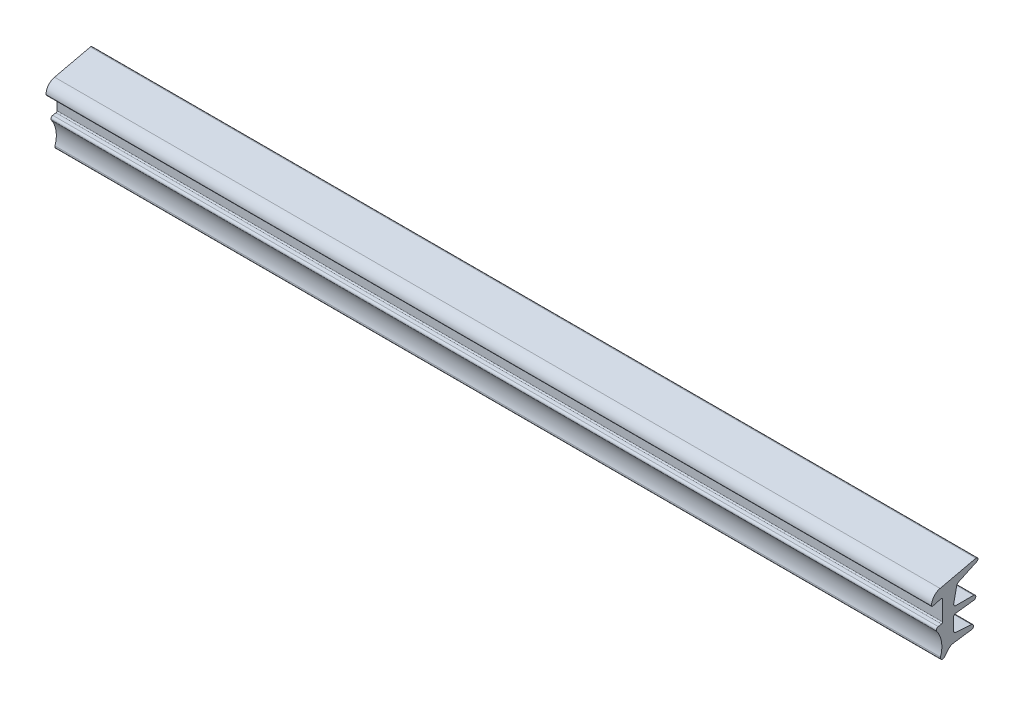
SolidWorks part; units mm, degrees
ref_plane "Front Plane" through (0, 0, 0) normal (0, 0, 1) x (1, 0, 0)
ref_plane "Top Plane" through (0, 0, 0) normal (0, 1, 0) x (1, 0, 0)
ref_plane "Right Plane" through (0, 0, 0) normal (1, 0, 0) x (0, 0, -1)
sketch3d "3DSketch1"
  line L0 (0, 0, 0) -> (200, 0, 0)
  dimension "D1" = 200
other "Paneelitiivisteet 1.6019 PANEELITIIVISTE 2(1)"
ref_plane "Plane1" through (0, 0, 0) normal (1, 0, 0) x (0, 0, -1)
sketch "Sketch1" plane through (0, 0, 0) normal (1, 0, 0) x (0, 0, -1)
  line L0 (2.3793, 4.7591) -> (6.4349, 6.6502)
  line L1 (6.1758, 7.4025) -> (-1.8966, 5.5389)
  line L2 (-3.8342, 3.1029) -> (-3.8342, 3.0945)
  line L3 (-3.5824, 2.9013) -> (-1.7118, 3.4025)
  line L4 (-1.3342, 3.1128) -> (-1.3342, -1.2872)
  line L5 (-1.5821, -1.5827) -> (-2.321, -1.713)
  line L6 (-2.6437, -2.4922) -> (-2.5838, -2.5778)
  line L7 (-0.9534, -8.4086) -> (-0.0613, -7.3455)
  line L8 (1.1924, -6.6506) -> (5.2354, -6.0824)
  line L9 (5.2007, -5.0884) -> (1.6309, -4.8388)
  line L10 (1.1658, -4.34) -> (1.1658, -1.5859)
  line L11 (1.6049, -1.0896) -> (5.7268, -0.5835)
  line L12 (5.6658, 0.4128) -> (1.6658, 0.4128)
  line L13 (1.1768, 1.0167) -> (1.8238, 4.0607)
  arc A0 (6.4349, 6.6502) -> (6.1758, 7.4025) centre (6.2658, 7.0128) ccw
  arc A1 (-1.8966, 5.5389) -> (-3.8342, 3.1029) centre (-1.3342, 3.1029) ccw
  arc A2 (-3.8342, 3.0945) -> (-3.5824, 2.9013) centre (-3.6342, 3.0945) ccw
  arc A3 (-1.3342, 3.1128) -> (-1.7118, 3.4025) centre (-1.6342, 3.1128) ccw
  arc A4 (-1.5821, -1.5827) -> (-1.3342, -1.2872) centre (-1.6342, -1.2872) ccw
  arc A5 (-2.321, -1.713) -> (-2.6437, -2.4922) centre (-2.2342, -2.2054) ccw
  arc A6 (-1.8104, -7.9281) -> (-2.5838, -2.5778) centre (-7.4987, -6.0193) ccw
  arc A7 (-1.8104, -7.9281) -> (-0.9534, -8.4086) centre (-1.3364, -8.0872) ccw
  arc A8 (1.1924, -6.6506) -> (-0.0613, -7.3455) centre (1.4708, -8.6311) ccw
  arc A9 (5.2354, -6.0824) -> (5.2007, -5.0884) centre (5.1658, -5.5872) ccw
  arc A10 (1.1658, -4.34) -> (1.6309, -4.8388) centre (1.6658, -4.34) ccw
  arc A11 (1.6049, -1.0896) -> (1.1658, -1.5859) centre (1.6658, -1.5859) ccw
  arc A12 (5.7268, -0.5835) -> (5.6658, 0.4128) centre (5.6658, -0.0872) ccw
  arc A13 (1.1768, 1.0167) -> (1.6658, 0.4128) centre (1.6658, 0.9128) ccw
  arc A14 (2.3793, 4.7591) -> (1.8238, 4.0607) centre (2.8019, 3.8528) ccw
  point P44 (0, 0)
